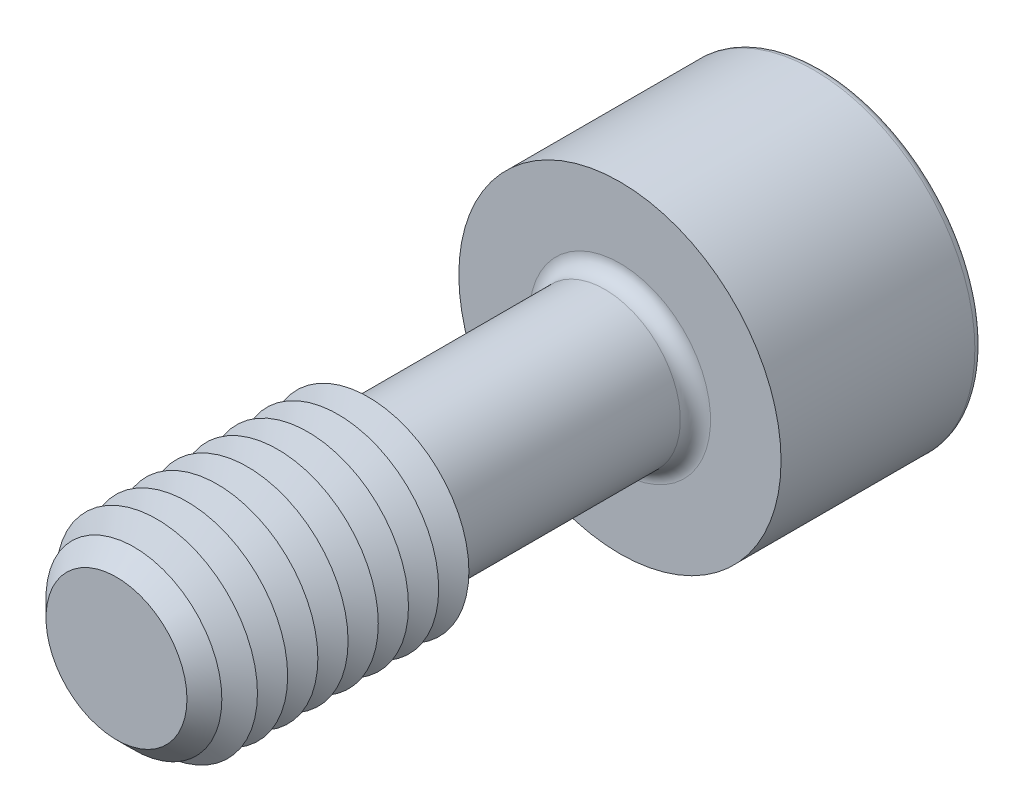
SolidWorks part; units mm, degrees
ref_plane "Front Plane" through (0, 0, 0) normal (0, 0, 1) x (1, 0, 0)
ref_plane "Top Plane" through (0, 0, 0) normal (0, 1, 0) x (1, 0, 0)
ref_plane "Right Plane" through (0, 0, 0) normal (1, 0, 0) x (0, 0, -1)
sketch "Sketch1" plane through (0, 0, 0) normal (0, 0, 1) x (1, 0, 0)
  circle A0 centre (0, 0) radius 3.75
  dimension "D1" = 7.5
extrude "Extrude1" add sketch "Sketch1" along normal mid plane 25
sketch "Sketch2" plane through (0, 0, 0) normal (1, 0, 0) x (0, 0, -1)
  line L0 (-12.5, 0) -> (-12.5, 5)
  line L1 (-12.5, 3.75) -> (-12.5, -3.75) construction
  line L2 (-12.5, 5) -> (0, 5)
  line L3 (0, 5) -> (0.7217, 3.75)
  line L4 (12.5, 3.75) -> (-12.5, 3.75) construction
  line L5 (0.7217, 3.75) -> (0.7217, 0)
  line L6 (0.7217, 0) -> (-12.5, 0)
  dimension "D1" = 5
  dimension "D2" = 120
  dimension "D3" = 12.5
revolve "Revolve1" add sketch "Sketch2" angle 360 about L6
chamfer "Chamfer1" distance 1.5 angle 45 1 edges at (0, 5, 12.5)
sketch "Sketch3" plane through (0, 0, -12.5) normal (0, 0, -1) x (-1, 0, 0)
  circle A0 centre (0, 0) radius 8
  dimension "D1" = 16
extrude "Extrude2" add sketch "Sketch3" along normal blind 10
sketch "Sketch4" plane through (-13.7, 0, -22.5) normal (0, 0, 1) x (1, 0, 0)
  line L2 (11.3906, -4) -> (16.0094, -4)
  line L3 (16.0094, -4) -> (18.3188, 0)
  line L4 (18.3188, 0) -> (16.0094, 4)
  line L6 (16.0094, 4) -> (11.3906, 4)
  line L7 (11.3906, 4) -> (9.0812, 0)
  line L8 (9.0812, 0) -> (11.3906, -4)
  circle A0 centre (13.7, 0) radius 4 construction
  dimension "D1" = 8
extrude "Extrude3" cut sketch "Sketch4" along normal blind 8
fillet "Fillet1" radius 0.75 1 edges at (-3.75, 0, -12.5)
fillet "Fillet2" radius 0.375 1 edges at (-8, 0, -22.5)
sketch "Sketch5" plane through (0, 0, 0) normal (1, 0, 0) x (0, 0, -1)
  line L0 (14.5, 0) -> (14.5, -4)
  line L1 (14.5, -4) -> (12.1906, 0)
  line L2 (12.1906, 0) -> (14.5, 0)
  dimension "D1" = 30
revolve "Cut-Revolve1" cut sketch "Sketch5" angle 360 about L2
sketch "Sketch6" plane through (0, 0, 0) normal (1, 0, 0) x (0, 0, -1)
  line L0 (1.332, 0) -> (-13.289, 0) construction
sketch "Sketch7" plane through (0, 0, 0) normal (1, 0, 0) x (0, 0, -1)
  line L0 (0, 5) -> (-0.75, 3.701)
  line L1 (-0.75, 3.701) -> (-1.5, 5)
  line L2 (0, 5) -> (-11, 5) construction
  line L3 (-1.5, 5) -> (0, 5)
  dimension "D1" = 1.5
revolve "Cut-Revolve2" cut sketch "Sketch7" angle 360 about L0
pattern_linear "LPattern1" count 8 spacing 1.5 along (0, 0, 1) of "Cut-Revolve2"
